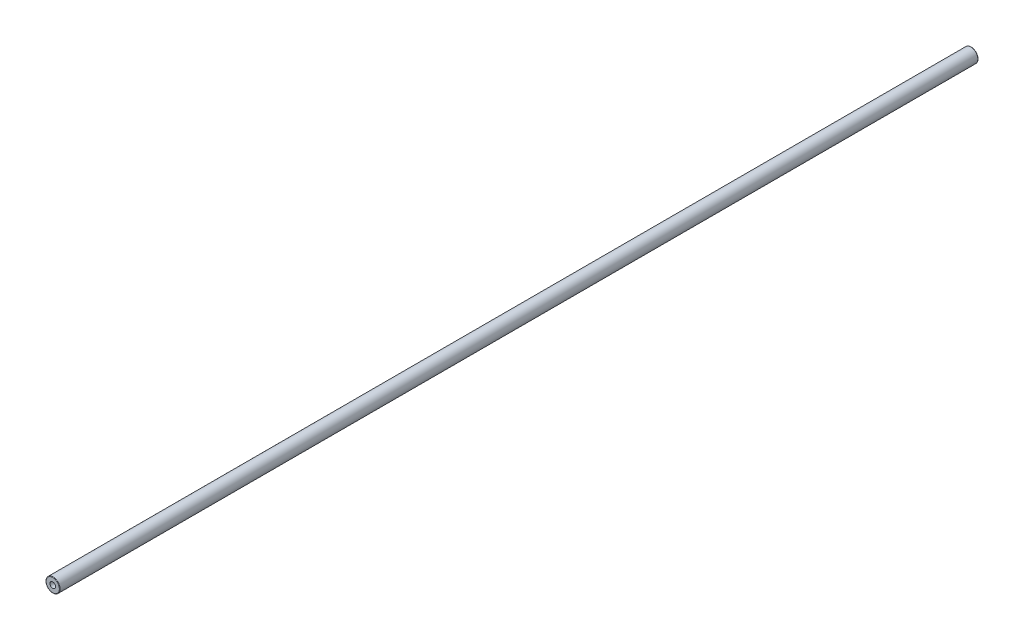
SolidWorks part; units mm, degrees
ref_plane "Front Plane" through (0, 0, 0) normal (0, 0, 1) x (1, 0, 0)
ref_plane "Top Plane" through (0, 0, 0) normal (0, 1, 0) x (1, 0, 0)
ref_plane "Right Plane" through (0, 0, 0) normal (1, 0, 0) x (0, 0, -1)
sketch "Sketch1" plane through (0, 0, 0) normal (0, 0, 1) x (1, 0, 0)
  circle A0 centre (0, 0) radius 3.175
  circle A1 centre (0, 0) radius 7.9375
  dimension "D1" = 6.35
  dimension "D2" = 15.875
extrude "Boss-Extrude1" add sketch "Sketch1" along normal blind 1041.4
fillet "Fillet1" radius 0.508 2 edges at (7.9375, 0, 0) (7.9375, 0, 1041.4)
sketch "Sketch2" plane through (0, 0, 0) normal (1, 0, 0) x (0, 0, -1)
  line L0 (0, 0) -> (-615.95, 0) construction
  line L1 (-615.95, 0) -> (-615.95, 24.2647) construction
  dimension "D1" = 615.95
